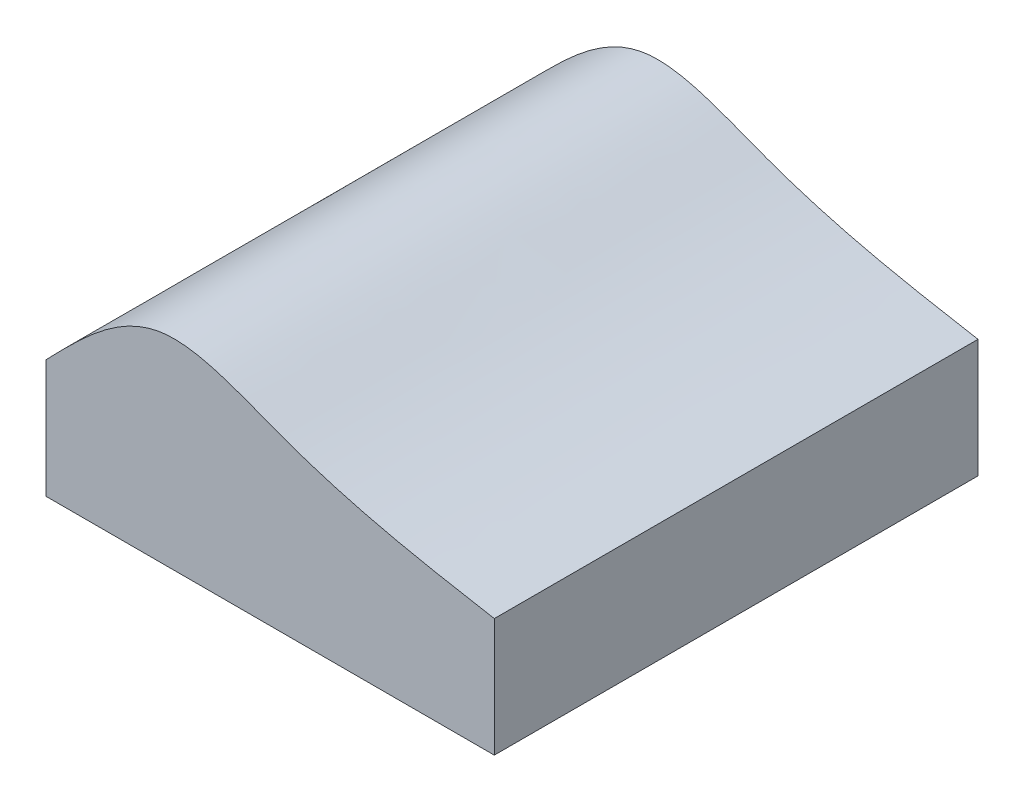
SolidWorks part; units mm, degrees
ref_plane "Front" through (0, 0, 0) normal (0, 0, 1) x (1, 0, 0)
ref_plane "Top" through (0, 0, 0) normal (0, 1, 0) x (1, 0, 0)
ref_plane "Right" through (0, 0, 0) normal (1, 0, 0) x (0, 0, -1)
sketch "Sketch1" plane through (0, 0, 0) normal (0, 0, 1) x (1, 0, 0)
  line L0 (0, 0) -> (84.3436, 0)
  line L1 (84.3436, 0) -> (84.3436, 22.2548)
  line L2 (0, 0) -> (0, 22.2548)
  spline_without_curve S0
extrude "Extrude1" add sketch "Sketch1" along normal mid plane 91
ref_plane "Plane1" through (0, 40, 0) normal (0, 1, 0) x (-1, 0, 0)
sketch "Sketch2" plane through (0, 40, 0) normal (0, 1, 0) x (-1, 0, 0)
  arc A0 (-53.4503, 33.5176) -> (-58.1588, -36.4799) centre (-77.8231, 0) cw
